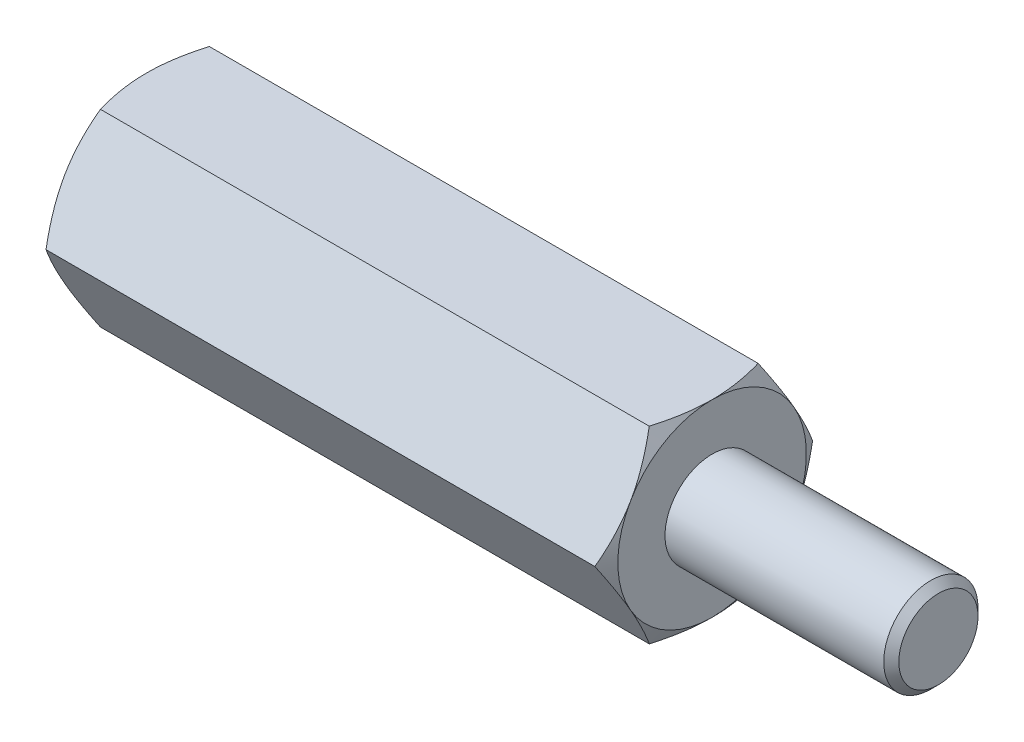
SolidWorks part; units mm, degrees
ref_plane "Front Plane" through (0, 0, 0) normal (0, 0, 1) x (1, 0, 0)
ref_plane "Top Plane" through (0, 0, 0) normal (0, 1, 0) x (1, 0, 0)
ref_plane "Right Plane" through (0, 0, 0) normal (1, 0, 0) x (0, 0, -1)
sketch "Sketch1" plane through (0, 0, 0) normal (1, 0, 0) x (0, 0, -1)
  line L1 (1.4434, 2.5) -> (-1.4434, 2.5)
  line L2 (-1.4434, 2.5) -> (-2.8868, 0)
  line L3 (-2.8868, 0) -> (-1.4434, -2.5)
  line L4 (-1.4434, -2.5) -> (1.4434, -2.5)
  line L5 (1.4434, -2.5) -> (2.8868, 0)
  line L6 (2.8868, 0) -> (1.4434, 2.5)
  circle A0 centre (0, 0) radius 2.5 construction
  dimension "D1" = 5
extrude "Extrude2" add sketch "Sketch1" along normal mid plane 15
sketch "Sketch2" plane through (0, 0, 0) normal (0, 0, 1) x (1, 0, 0)
  line L0 (-7.5, 2.5) -> (-6, 5.0981)
  line L1 (-7.5, 5.5) -> (-7.5, 2.5)
  line L3 (0, 0) -> (50000, 0) construction
  arc A0 (-6, 5.0981) -> (-7.5, 5.5) centre (-6.6962, 5.5) ccw
  dimension "D1" = 30
  dimension "D2" = 3
revolve "Cut-Revolve1" cut sketch "Sketch2" angle 360 about L3
mirror "Mirror1" about plane through (0, 0, 0) normal (1, 0, 0) of "Cut-Revolve1"
sketch "Sketch3" plane through (-7.5, 0, 0) normal (-1, 0, 0) x (0, 0, 1)
  circle A0 centre (0, 0) radius 1.05
  dimension "D1" = 2.1
extrude "Extrude3" cut sketch "Sketch3" against normal blind 6
sketch "Sketch4" plane through (0, 0, 0) normal (0, 0, 1) x (1, 0, 0)
  line L0 (-1.5, 0) -> (-1.5, 1.05)
  line L1 (7.2767, 0) -> (-7.2767, 0) construction
  line L2 (-1.5, 1.05) -> (-0.8938, 0)
  line L3 (-0.8938, 0) -> (-1.5, 0)
  line L4 (-7.5, 1.25) -> (-7.5, -1.25) construction
  point P4 (-7.5, 0)
  dimension "D1" = 30
  dimension "D2" = 1.05
  dimension "D3" = 6
revolve "Cut-Revolve2" cut sketch "Sketch4" angle 360 about L3
sketch "Sketch5" plane through (7.5, 0, 0) normal (1, 0, 0) x (0, 0, -1)
  circle A0 centre (0, 0) radius 1.25
  dimension "D1" = 2.5
extrude "Extrude4" add sketch "Sketch5" along normal blind 6
chamfer "Chamfer1" distance 0.2 angle 45 1 edges at (13.5, 0, -1.25)
equation "\"D2@Sketch4\" = \"D1@Sketch3\"/2"
